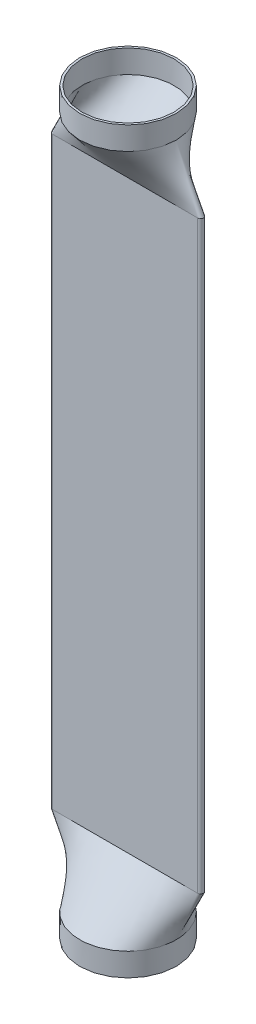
SolidWorks part; units mm, degrees
ref_plane "Front Plane" through (0, 0, 0) normal (0, 0, 1) x (1, 0, 0)
ref_plane "Top Plane" through (0, 0, 0) normal (0, 1, 0) x (1, 0, 0)
ref_plane "Right Plane" through (0, 0, 0) normal (1, 0, 0) x (0, 0, -1)
sketch "Sketch1" plane through (0, 0, 0) normal (0, 1, 0) x (1, 0, 0)
  circle A0 centre (0, 0) radius 38.1
  circle A1 centre (0, 0) radius 39.9034
  dimension "D1" = 1.8034
  dimension "D2" = 76.2
extrude "Boss-Extrude1" add sketch "Sketch1" along normal blind 19.05
sketch "Sketch2" plane through (0, 19.05, 0) normal (0, 1, 0) x (1, 0, 0)
  circle A0 centre (0, 0) radius 39.9034
  circle A2 centre (0, 0) radius 39.9034 construction
  point P2 (0, -39.9034)
ref_plane "Plane1" through (0, 63.5, 0) normal (0, 1, 0) x (1, 0, 0)
sketch "Sketch3" plane through (0, 63.5, 0) normal (0, 1, 0) x (1, 0, 0)
  line L0 (59.871, 0) -> (-59.871, 0) construction
  line L1 (59.871, -2.4384) -> (-59.871, -2.4384)
  line L2 (59.871, 2.4384) -> (-59.871, 2.4384)
  arc A0 (59.871, -2.4384) -> (59.871, 2.4384) centre (59.871, 0) ccw
  arc A3 (-59.871, 2.4384) -> (-59.871, -2.4384) centre (-59.871, 0) ccw
  point P2 (0, 0)
  dimension "D2" = 124.6188
  dimension "D1" = 4.8768
loft "Loft5" add profiles "Sketch2", "Sketch3"
sketch "Sketch6" plane through (0, 63.5, 0) normal (0, 1, 0) x (1, 0, 0)
  line L4 (-59.871, -0.635) -> (59.871, -0.635)
  line L5 (59.871, 0.635) -> (-59.871, 0.635)
  line L6 (-59.871, -0.635) -> (59.871, -0.635)
  line L7 (59.871, 0.635) -> (-59.871, 0.635)
  arc A4 (-59.871, 0.635) -> (-59.871, -0.635) centre (-59.871, 0) ccw
  arc A5 (59.871, -0.635) -> (59.871, 0.635) centre (59.871, 0) ccw
  arc A6 (-59.871, 0.635) -> (-59.871, -0.635) centre (-59.871, 0) ccw
  arc A7 (59.871, -0.635) -> (59.871, 0.635) centre (59.871, 0) ccw
  dimension "D1" = 1.8034
ref_plane "Plane3" through (0, 19.05, 0) normal (0, 1, 0) x (1, 0, 0)
sketch "Sketch7" plane through (0, 19.05, 0) normal (0, 1, 0) x (1, 0, 0)
  circle A0 centre (0, 0) radius 38.1
  circle A1 centre (0, 0) radius 38.1 construction
loft "Cut-Loft1" cut profiles "Sketch7", "Sketch6"
ref_plane "Plane5" through (0, 304.8, 0) normal (0, -1, 0) x (-1, 0, 0)
sketch "Sketch8" plane through (0, 63.5, 0) normal (0, 1, 0) x (1, 0, 0)
  line L4 (59.871, 2.4384) -> (-59.871, 2.4384)
  line L5 (-59.871, -2.4384) -> (59.871, -2.4384)
  line L6 (59.871, 2.4384) -> (-59.871, 2.4384)
  line L7 (-59.871, -2.4384) -> (59.871, -2.4384)
  line L15 (-59.871, -0.635) -> (59.871, -0.635)
  line L16 (59.871, 0.635) -> (-59.871, 0.635)
  line L17 (-59.871, -0.635) -> (59.871, -0.635)
  line L18 (59.871, 0.635) -> (-59.871, 0.635)
  arc A6 (-59.871, 0.635) -> (-59.871, -0.635) centre (-59.871, 0) ccw
  arc A7 (59.871, -0.635) -> (59.871, 0.635) centre (59.871, 0) ccw
  arc A8 (-59.871, 0.635) -> (-59.871, -0.635) centre (-59.871, 0) ccw
  arc A9 (59.871, -0.635) -> (59.871, 0.635) centre (59.871, 0) ccw
  spline S2 degree 3 poles (59.871, -2.4384) (64.7478, -2.4384) (64.7478, 2.4384) (59.871, 2.4384) knots 0 0 0 0 1 1 1 1 weights 1 0.333333 0.333333 1
  spline S3 degree 3 poles (59.871, -2.4384) (64.7478, -2.4384) (64.7478, 2.4384) (59.871, 2.4384) knots 0 0 0 0 1 1 1 1 weights 1 0.333333 0.333333 1
  spline S4 degree 3 poles (-59.871, 2.4384) (-64.7478, 2.4384) (-64.7478, -2.4384) (-59.871, -2.4384) knots 0 0 0 0 1 1 1 1 weights 1 0.333333 0.333333 1
  spline S5 degree 3 poles (-59.871, 2.4384) (-64.7478, 2.4384) (-64.7478, -2.4384) (-59.871, -2.4384) knots 0 0 0 0 1 1 1 1 weights 1 0.333333 0.333333 1
  dimension "D1" = 0
  dimension "D2" = 0
extrude "Boss-Extrude2" add sketch "Sketch8" along normal up to surface (241.3 mm away)
mirror "Mirror6" about plane through (0, 304.8, 0) normal (0, -1, 0) of "Boss-Extrude2"
mirror "Mirror7" about plane through (0, 304.8, 0) normal (0, -1, 0) of "Cut-Loft1", "Loft5"
sketch "Sketch9" [suppressed] plane through (0, 38.1, 0) normal (0, 1, 0) x (1, 0, 0)
  circle A0 centre (0, 0) radius 39.9034
  circle A1 centre (0, 0) radius 38.1
  circle A2 centre (0, 0) radius 38.1 construction
  circle A3 centre (0, 0) radius 39.9034 construction
extrude "Boss-Extrude3" [suppressed] add sketch "Sketch9" along normal up to surface (266.7 mm away)
mirror "Mirror8" about plane through (0, 304.8, 0) normal (0, -1, 0) of "Boss-Extrude3", "Boss-Extrude1"
sketch "Sketch10" [suppressed] plane through (0, 0, 0) normal (0, -1, 0) x (1, 0, 0)
  circle A0 centre (0, 0) radius 38.1
  circle A1 centre (0, 0) radius 38.1 construction
extrude "Boss-Extrude4" [suppressed] add sketch "Sketch10" against normal up to surface (571.5 mm away)
